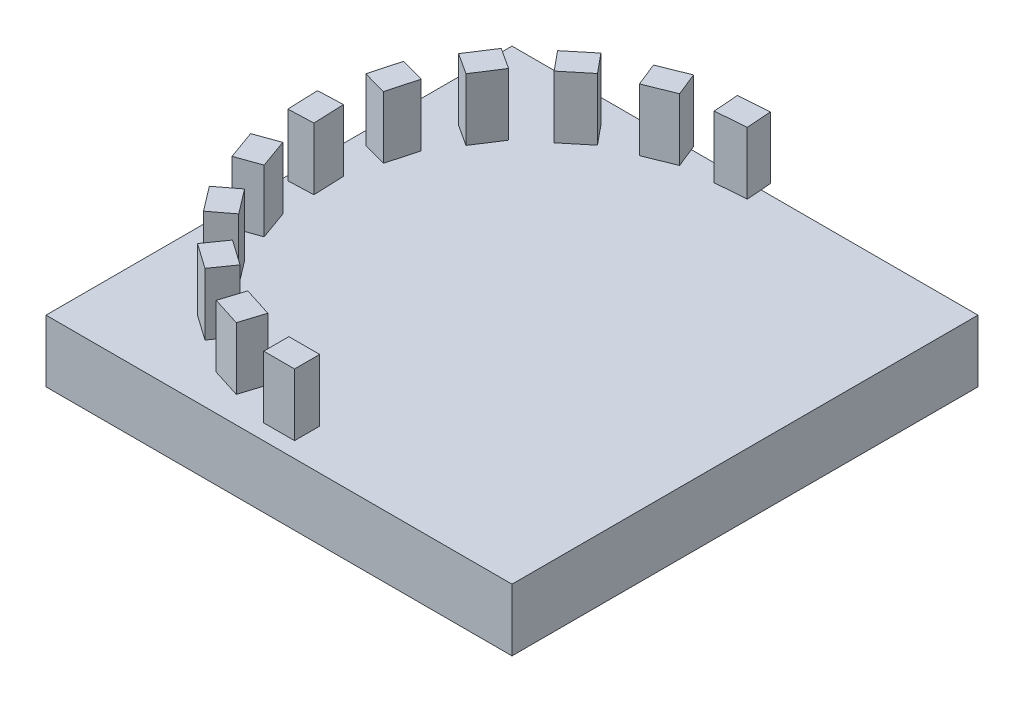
SolidWorks part; units mm, degrees
ref_plane "Front" through (0, 0, 0) normal (0, 0, 1) x (1, 0, 0)
ref_plane "Top" through (0, 0, 0) normal (0, 1, 0) x (1, 0, 0)
ref_plane "Right" through (0, 0, 0) normal (1, 0, 0) x (0, 0, -1)
sketch "Sketch1" plane through (0, 0, 0) normal (0, 1, 0) x (1, 0, 0)
  line L0 (75, -75) -> (-75, 75) construction
  line L1 (-75, 75) -> (75, 75)
  line L2 (-75, 75) -> (-75, -75)
  line L3 (-75, -75) -> (75, -75)
  line L4 (75, 75) -> (75, -75)
  dimension "D1" = 150
  dimension "D2" = 150
extrude "Extrude1" add sketch "Sketch1" along normal blind 20
sketch "Sketch2" plane through (0, 20, 0) normal (0, 1, 0) x (-1, 0, 0)
  arc A0 (0, 70) -> (0, -70) centre (0, 0) cw construction
  dimension "D1" = 70
sketch "Sketch3" plane through (0, 20, 0) normal (0, 1, 0) x (-1, 0, 0)
  line L1 (0, 70) -> (9.9157, 70)
  line L2 (0, 70) -> (0, 61.911)
  line L3 (0, 61.911) -> (9.9157, 61.911)
  line L4 (9.9157, 70) -> (9.9157, 61.911)
  arc A0 (0, -70) -> (0, 70) centre (0, 0) ccw construction
extrude "Extrude2" add sketch "Sketch3" along normal blind 20
pattern_curve "CrvPattern1" of "Extrude2" parameters "D1"=11, "D3"=50, "D2"=1, "D4"=50
